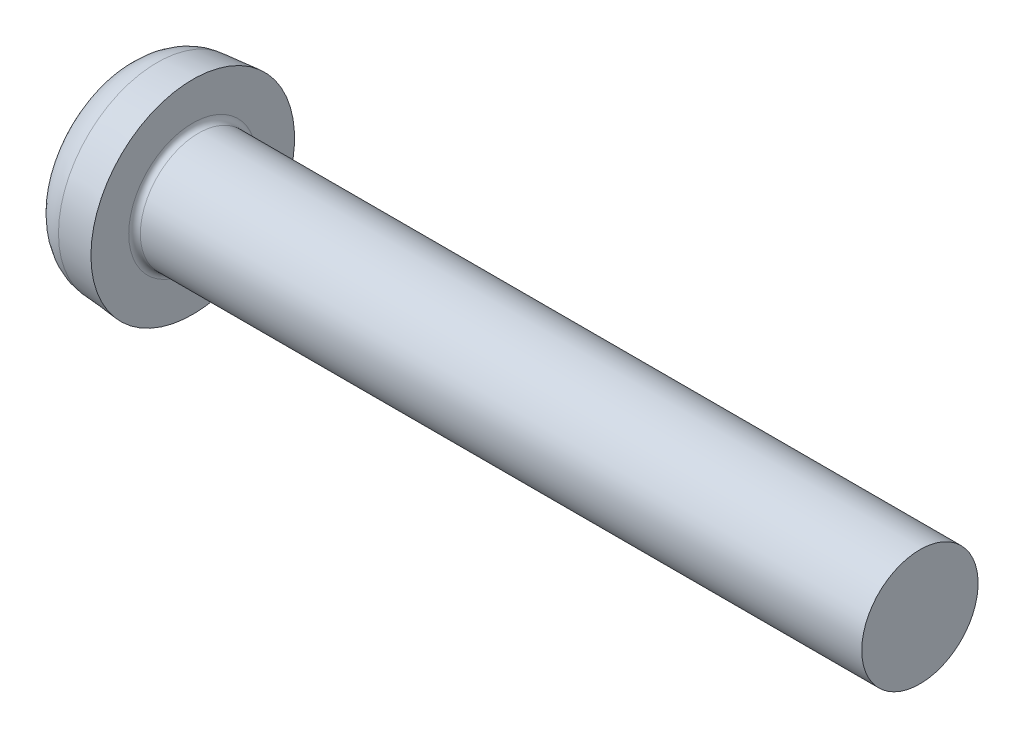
SolidWorks part; units mm, degrees
ref_plane "Front Plane" through (0, 0, 0) normal (0, 0, 1) x (1, 0, 0)
ref_plane "Top Plane" through (0, 0, 0) normal (0, 1, 0) x (1, 0, 0)
ref_plane "Right Plane" through (0, 0, 0) normal (1, 0, 0) x (0, 0, -1)
sketch "BodySke" plane through (0, 0, 0) normal (0, 0, 1) x (1, 0, 0)
  line L0 (0, 0) -> (111.3824, 0) construction
  line L1 (0, 0) -> (0, 8) construction
  line L2 (5.4, 4) -> (5.4, 7)
  line L3 (5.4, 7) -> (2.9561, 6.7862)
  line L4 (5.4, 4) -> (55.4, 4)
  line L5 (55.4, 4) -> (55.4, 0)
  line L6 (6.65, 7.824) -> (6.65, -6.8939) construction
  line L7 (0, 0) -> (55.4, 0)
  line L8 (25.4, 8.824) -> (25.4, -4.958) construction
  arc A0 (2.9561, 6.7862) -> (0.6811, 4.9045) centre (3.1827, 4.1961) ccw
  arc A1 (0.6811, 4.9045) -> (0, 0) centre (18, 0) ccw
  point P10 (55.4, 3.4455)
  dimension "D1" = 5
  dimension "Head_side_radius" = 2.6
  dimension "Head_radius" = 18
  dimension "Diameter" = 8
  dimension "Head_dia" = 14
  dimension "Head_height" = 5.4
  dimension "Length" = 50
  dimension "Advance" = 1.25
  dimension "Thread_minor" = 6.891
  dimension "Thread_length" = 30
revolve "BaseBody" add sketch "BodySke" angle 360 about L0
fillet "Fillet1" radius 0.4 1 edges at (5.4, 0, 4)
ref_plane "Plane1" through (4.36, 0, 0) normal (1, 0, 0) x (0, 0, -1)
sketch "RecSkeTop" plane through (0, 0, 0) normal (1, 0, 0) x (0, 0, -1)
  line L1 (-0.858, 3.9) -> (0.858, 3.9)
  line L2 (-0.858, 3.9) -> (-0.858, -3.9)
  line L3 (-0.858, -3.9) -> (0.858, -3.9)
  line L4 (0.858, 3.9) -> (0.858, -3.9)
  dimension "D1" = 3.9
  dimension "Cross_dia" = 7.8
  dimension "D2" = 1.716
  dimension "D3" = 0.858
sketch "RecSkeBot" plane through (4.36, 0, 0) normal (1, 0, 0) x (0, 0, -1)
  line L0 (-0.858, 3.9) -> (-0.858, -3.9) construction
  line L1 (-0.858, 1.7262) -> (0.858, 1.7262)
  line L2 (-0.858, 1.7262) -> (-0.858, -1.7262)
  line L3 (-0.858, -1.7262) -> (0.858, -1.7262)
  line L4 (0.858, 1.7262) -> (0.858, -1.7262)
  line L5 (0.858, 3.9) -> (0.858, -3.9) construction
  dimension "D1" = 3.4524
  dimension "D2" = 1.7262
loft "Recess" cut profiles "RecSkeTop", "RecSkeBot"
pattern_circular "RecPat" count 2 every 90 about axis through (0, 0, 0) along (1, 0, 0) of "Recess"
sketch "RecCorSke" plane through (0, 0, 0) normal (0, 0, 1) x (1, 0, 0)
  line L0 (0, 0) -> (57.5987, 0) construction
  line L1 (0, 0) -> (0, 1.8876)
  line L3 (0, 1.8876) -> (4.36, 1.5827)
  line L4 (4.36, 1.5827) -> (4.8743, 0)
  line L5 (4.8743, 0) -> (0, 0)
  dimension "D1" = 18
  dimension "D2" = 4.36
  dimension "D3" = 1.8876
  dimension "D4" = 4
revolve "RecessCore" cut sketch "RecCorSke" angle 360 about L0
sketch "ThdSchSke" plane through (0, 0, 0) normal (0, 0, 1) x (1, 0, 0)
  line L0 (0, 0) -> (55.1256, 0) construction
  line L1 (0, 0) -> (111.3824, 0) construction
  line L2 (55.0799, 4) -> (55.0799, 4.6403)
  line L3 (55.0799, 4.6403) -> (55.7201, 4.6403)
  line L4 (55.7201, 4.6403) -> (55.7201, 4)
  line L5 (55.7201, 4) -> (55.4, 3.4455)
  line L6 (55.4, 3.4455) -> (55.0799, 4)
  line L7 (5.4, 4) -> (55.4, 4) construction
  line L13 (55.4, 4) -> (55.4, 0) construction
revolve "ThreadSchematic" [suppressed] cut sketch "ThdSchSke" angle 360 about L0
pattern_linear "ThdSchPat" [suppressed] count 24 along (1, 0, 0)
equation "\"Thread_minor@ThreadCosmetic\" = \"Thread_minor@BodySke\""
equation "\"D1@RecSkeTop\" = \"Cross_dia@RecSkeTop\" / 2"
equation "\"D2@RecSkeTop\" = \"Cross_dia@RecSkeTop\" * 0.22"
equation "\"D3@RecSkeTop\" = \"D2@RecSkeTop\" / 2"
equation "\"D1@RecSkeBot\" = \"Cross_dia@RecSkeTop\" - 2 * \"Cross_depth@Plane1\" *  tan( 26.5 * 0.017453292 ) "
equation "\"D2@RecSkeBot\" = \"D1@RecSkeBot\" / 2"
equation "\"D2@RecCorSke\" = \"Cross_depth@Plane1\""
equation "\"D3@RecCorSke\" = \"D2@RecSkeTop\" * 1.1"
equation "\"Advance@ThdSchPat\" = \"Advance@BodySke\""
equation "\"D1@ThdSchPat\" =  int( \"Thread_length@BodySke\" / \"Advance@ThdSchPat\" ) "
